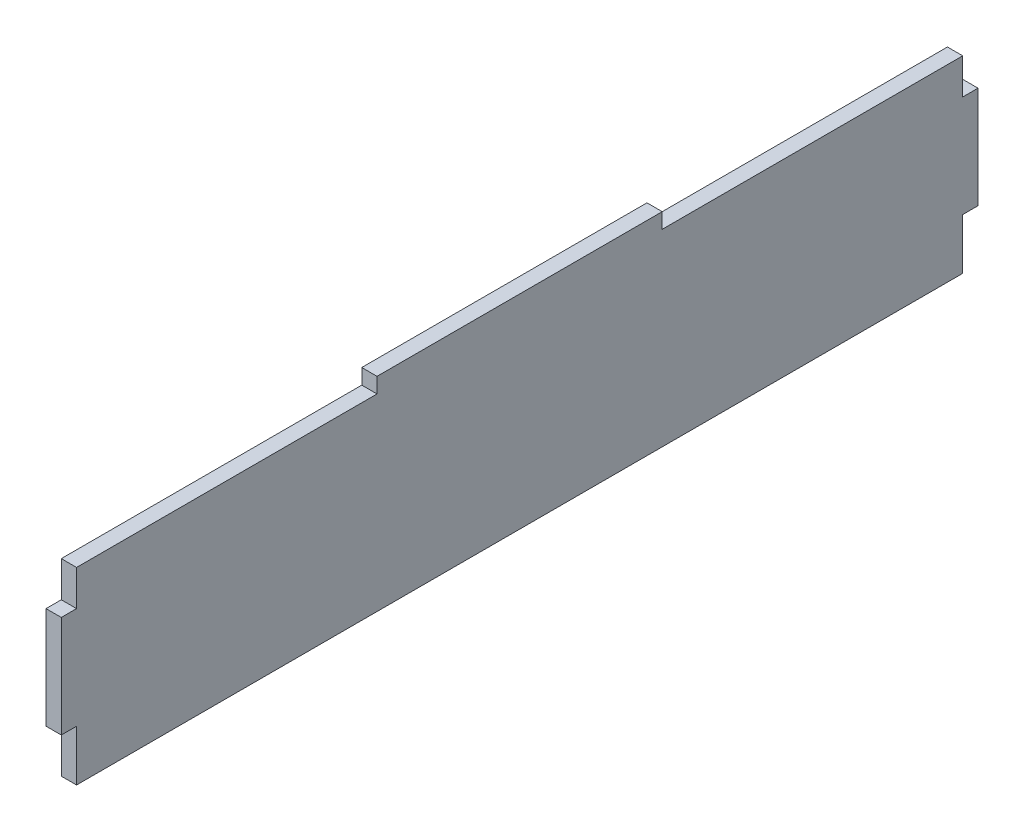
SolidWorks part; units mm, degrees
ref_plane "Plan de face" through (0, 0, 0) normal (0, 0, 1) x (1, 0, 0)
ref_plane "Plan de dessus" through (0, 0, 0) normal (0, 1, 0) x (1, 0, 0)
ref_plane "Plan de droite" through (0, 0, 0) normal (1, 0, 0) x (0, 0, -1)
sketch "Esquisse1" plane through (0, 0, 0) normal (1, 0, 0) x (0, 0, -1)
  line L1 (-90, 20) -> (90, 20)
  line L2 (-90, 20) -> (-90, -20)
  line L3 (-90, -20) -> (90, -20)
  line L4 (90, 20) -> (90, -20)
  line L5 (-90, 20) -> (90, -20) construction
  line L6 (-90, -20) -> (90, 20) construction
  point P0 (0, 0)
  dimension "D1" = 40
  dimension "D2" = 180
extrude "Boss.-Extru.1" add sketch "Esquisse1" along normal blind 3
sketch "Esquisse2" plane through (3, 0, 0) normal (1, 0, 0) x (0, 0, -1)
  line L0 (-90, 0) -> (98.2744, 0) construction
  line L1 (-90, 20) -> (-90, -20) construction
  line L2 (0, -20) -> (0, 34.6144) construction
  line L3 (-87, 17) -> (-87, 10)
  line L4 (-90, -20) -> (-87, -20)
  line L5 (-90, -20) -> (-90, -10)
  line L6 (-90, -10) -> (-87, -10)
  line L7 (-87, -20) -> (-87, -10)
  line L8 (-90, 10) -> (-87, 10)
  line L9 (-90, -20) -> (90, -20) construction
  line L11 (90, 20) -> (90, 10)
  line L13 (90, 10) -> (87, 10)
  line L14 (87, -20) -> (87, -10)
  line L15 (90, -10) -> (87, -10)
  line L16 (28, 20) -> (28, 17)
  line L17 (-90, 20) -> (-28, 20)
  line L19 (-87, 17) -> (-28, 17)
  line L20 (-28, 20) -> (-28, 17)
  line L21 (87, 17) -> (28, 17)
  line L22 (90, -20) -> (90, -10)
  line L23 (90, 20) -> (28, 20)
  line L24 (-90, 20) -> (-90, 10)
  line L26 (90, -20) -> (87, -20)
  line L27 (87, 17) -> (87, 10)
  point P9 (-87, -15)
  dimension "D1" = 10
  dimension "D2" = 3
  dimension "D3" = 3
  dimension "D4" = 28
extrude "Enlèv. mat.-Extru.1" cut sketch "Esquisse2" against normal through all
